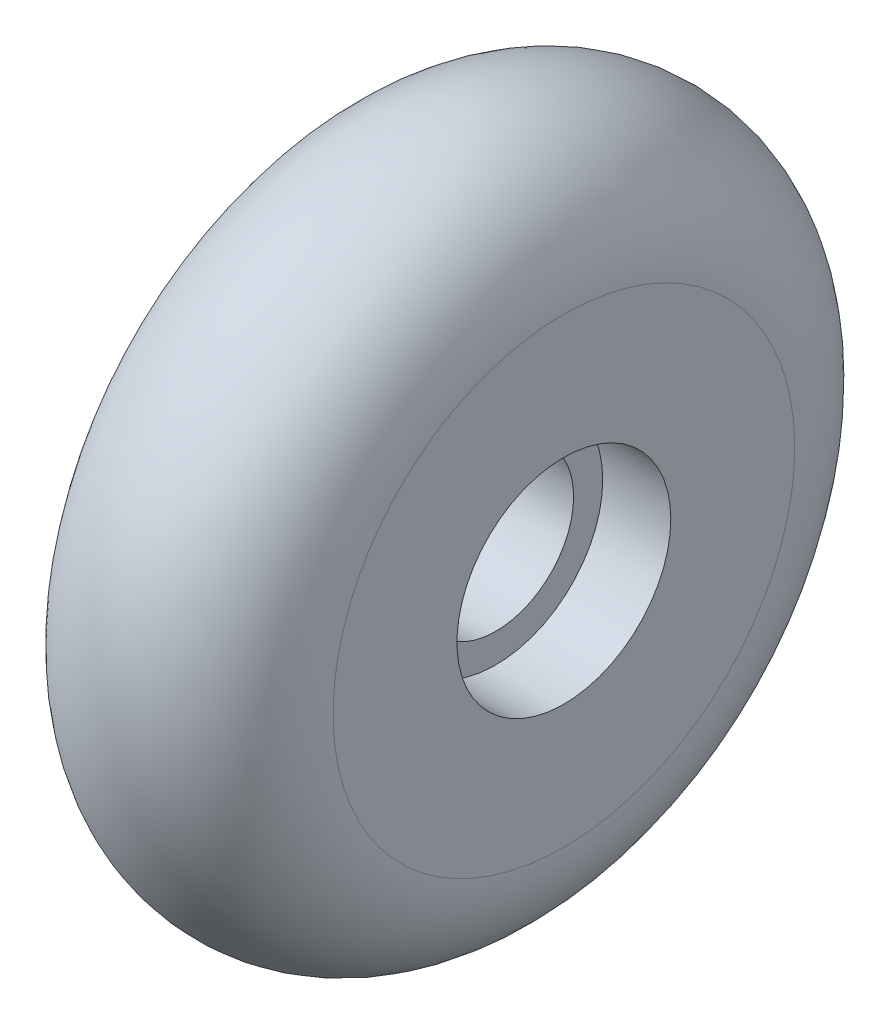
SolidWorks part; units mm, degrees
ref_plane "Front Plane" through (0, 0, 0) normal (0, 0, 1) x (1, 0, 0)
ref_plane "Top Plane" through (0, 0, 0) normal (0, 1, 0) x (1, 0, 0)
ref_plane "Right Plane" through (0, 0, 0) normal (1, 0, 0) x (0, 0, -1)
sketch "Sketch1" plane through (0, 0, 0) normal (0, 0, 1) x (1, 0, 0)
  line L0 (0, -12.75) -> (0, 0)
  line L1 (0, -12.75) -> (-7, -12.75)
  line L2 (-7, -12.75) -> (-7, -15.75)
  line L3 (-7, -15.75) -> (-17.5, -15.75)
  line L4 (0, -23.75) -> (-20, -23.75) construction
  line L6 (-24.5, -12.75) -> (-24.5, 0)
  line L7 (-24.5, -12.75) -> (-17.5, -12.75)
  line L8 (-17.5, -15.75) -> (-17.5, -12.75)
  arc A0 (0, 0) -> (-24.5, 0) centre (-12.25, 0) ccw
  dimension "D1" = 24.5
  dimension "D2" = 23.75
  dimension "D3" = 11
  dimension "D4" = 7
  dimension "D5" = 7
  dimension "D7" = 23.75
  dimension "D8" = 3
  dimension "D9" = 3
revolve "Revolve1" add sketch "Sketch1" angle 360 about L4
